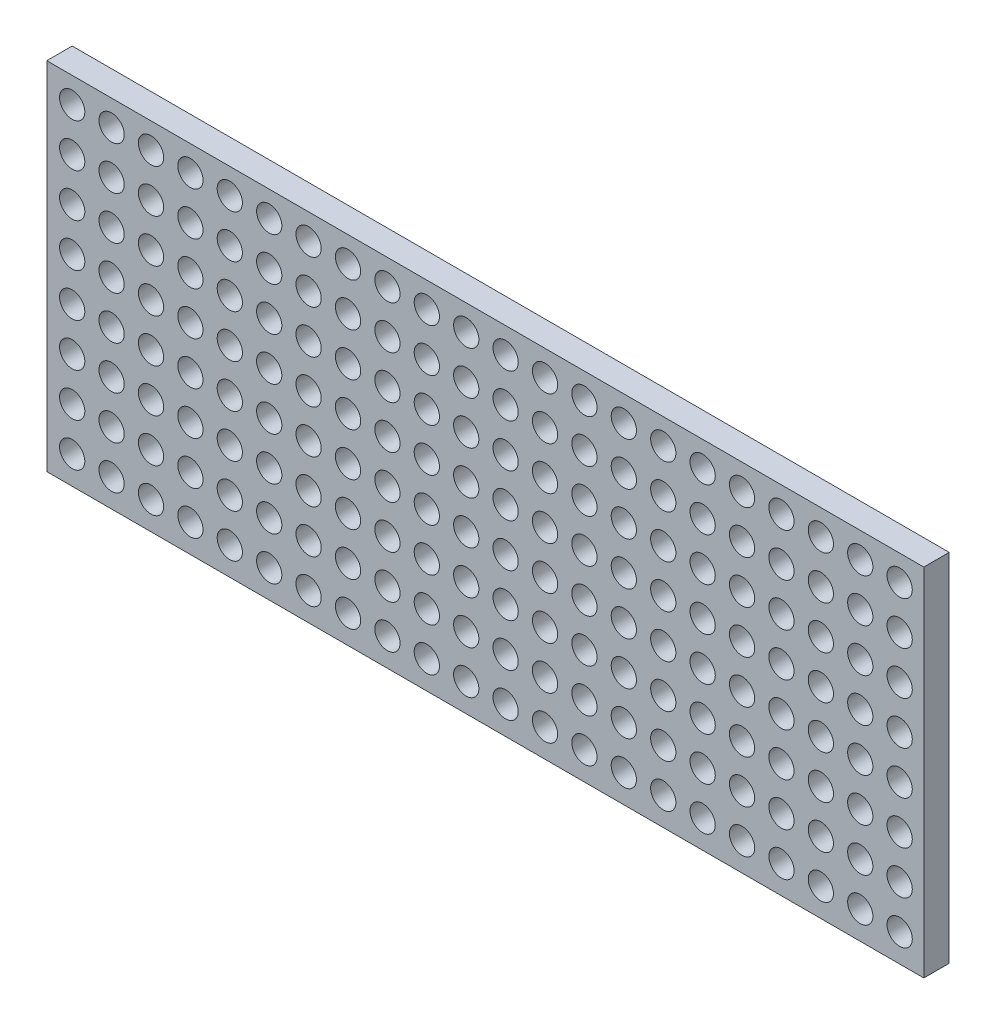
SolidWorks part; units mm, degrees
ref_plane "정면" through (0, 0, 0) normal (0, 0, 1) x (1, 0, 0)
ref_plane "윗면" through (0, 0, 0) normal (0, 1, 0) x (1, 0, 0)
ref_plane "우측면" through (0, 0, 0) normal (1, 0, 0) x (0, 0, -1)
sketch "스케치1" plane through (0, 0, 0) normal (0, 0, 1) x (1, 0, 0)
  line L1 (-3.45, 1.4) -> (3.45, 1.4)
  line L2 (-3.45, 1.4) -> (-3.45, -1.4)
  line L3 (-3.45, -1.4) -> (3.45, -1.4)
  line L4 (3.45, 1.4) -> (3.45, -1.4)
  line L5 (-3.45, 1.4) -> (3.45, -1.4) construction
  line L6 (-3.45, -1.4) -> (3.45, 1.4) construction
  point P0 (0, 0)
extrude "보스-돌출1" add sketch "스케치1" along normal blind 0.2
sketch "스케치2" plane through (0, 0, 0.2) normal (0, 0, 1) x (1, 0, 0)
  circle A0 centre (-3.25, 1.2) radius 0.0993
  circle A1 centre (-2.94, 1.2) radius 0.0993
  circle A2 centre (-2.63, 1.2) radius 0.0993
  circle A3 centre (-2.32, 1.2) radius 0.0993
  circle A4 centre (-2.01, 1.2) radius 0.0993
  circle A5 centre (-1.7, 1.2) radius 0.0993
  circle A6 centre (-1.39, 1.2) radius 0.0993
  circle A7 centre (-1.08, 1.2) radius 0.0993
  circle A8 centre (-0.77, 1.2) radius 0.0993
  circle A9 centre (-0.46, 1.2) radius 0.0993
  circle A10 centre (-0.15, 1.2) radius 0.0993
  circle A11 centre (0.16, 1.2) radius 0.0993
  circle A12 centre (0.47, 1.2) radius 0.0993
  circle A13 centre (0.78, 1.2) radius 0.0993
  circle A14 centre (1.09, 1.2) radius 0.0993
  circle A15 centre (1.4, 1.2) radius 0.0993
  circle A16 centre (1.71, 1.2) radius 0.0993
  circle A17 centre (2.02, 1.2) radius 0.0993
  circle A18 centre (2.33, 1.2) radius 0.0993
  circle A19 centre (2.64, 1.2) radius 0.0993
  circle A20 centre (2.95, 1.2) radius 0.0993
  circle A21 centre (3.26, 1.2) radius 0.0993
  circle A22 centre (-2.94, 0.86) radius 0.0993
  circle A23 centre (-2.63, 0.86) radius 0.0993
  circle A24 centre (-2.32, 0.86) radius 0.0993
  circle A25 centre (-2.01, 0.86) radius 0.0993
  circle A26 centre (-1.7, 0.86) radius 0.0993
  circle A27 centre (-1.39, 0.86) radius 0.0993
  circle A28 centre (-1.08, 0.86) radius 0.0993
  circle A29 centre (-0.77, 0.86) radius 0.0993
  circle A30 centre (-0.46, 0.86) radius 0.0993
  circle A31 centre (-0.15, 0.86) radius 0.0993
  circle A32 centre (0.16, 0.86) radius 0.0993
  circle A33 centre (0.47, 0.86) radius 0.0993
  circle A34 centre (0.78, 0.86) radius 0.0993
  circle A35 centre (1.09, 0.86) radius 0.0993
  circle A36 centre (1.4, 0.86) radius 0.0993
  circle A37 centre (1.71, 0.86) radius 0.0993
  circle A38 centre (2.02, 0.86) radius 0.0993
  circle A39 centre (2.33, 0.86) radius 0.0993
  circle A40 centre (2.64, 0.86) radius 0.0993
  circle A41 centre (2.95, 0.86) radius 0.0993
  circle A42 centre (3.26, 0.86) radius 0.0993
  circle A43 centre (-2.94, 0.52) radius 0.0993
  circle A44 centre (-2.63, 0.52) radius 0.0993
  circle A45 centre (-2.32, 0.52) radius 0.0993
  circle A46 centre (-2.01, 0.52) radius 0.0993
  circle A47 centre (-1.7, 0.52) radius 0.0993
  circle A48 centre (-1.39, 0.52) radius 0.0993
  circle A49 centre (-1.08, 0.52) radius 0.0993
  circle A50 centre (-0.77, 0.52) radius 0.0993
  circle A51 centre (-0.46, 0.52) radius 0.0993
  circle A52 centre (-0.15, 0.52) radius 0.0993
  circle A53 centre (0.16, 0.52) radius 0.0993
  circle A54 centre (0.47, 0.52) radius 0.0993
  circle A55 centre (0.78, 0.52) radius 0.0993
  circle A56 centre (1.09, 0.52) radius 0.0993
  circle A57 centre (1.4, 0.52) radius 0.0993
  circle A58 centre (1.71, 0.52) radius 0.0993
  circle A59 centre (2.02, 0.52) radius 0.0993
  circle A60 centre (2.33, 0.52) radius 0.0993
  circle A61 centre (2.64, 0.52) radius 0.0993
  circle A62 centre (2.95, 0.52) radius 0.0993
  circle A63 centre (3.26, 0.52) radius 0.0993
  circle A64 centre (-2.94, 0.18) radius 0.0993
  circle A65 centre (-2.63, 0.18) radius 0.0993
  circle A66 centre (-2.32, 0.18) radius 0.0993
  circle A67 centre (-2.01, 0.18) radius 0.0993
  circle A68 centre (-1.7, 0.18) radius 0.0993
  circle A69 centre (-1.39, 0.18) radius 0.0993
  circle A70 centre (-1.08, 0.18) radius 0.0993
  circle A71 centre (-0.77, 0.18) radius 0.0993
  circle A72 centre (-0.46, 0.18) radius 0.0993
  circle A73 centre (-0.15, 0.18) radius 0.0993
  circle A74 centre (0.16, 0.18) radius 0.0993
  circle A75 centre (0.47, 0.18) radius 0.0993
  circle A76 centre (0.78, 0.18) radius 0.0993
  circle A77 centre (1.09, 0.18) radius 0.0993
  circle A78 centre (1.4, 0.18) radius 0.0993
  circle A79 centre (1.71, 0.18) radius 0.0993
  circle A80 centre (2.02, 0.18) radius 0.0993
  circle A81 centre (2.33, 0.18) radius 0.0993
  circle A82 centre (2.64, 0.18) radius 0.0993
  circle A83 centre (2.95, 0.18) radius 0.0993
  circle A84 centre (3.26, 0.18) radius 0.0993
  circle A85 centre (-2.94, -0.16) radius 0.0993
  circle A86 centre (-2.63, -0.16) radius 0.0993
  circle A87 centre (-2.32, -0.16) radius 0.0993
  circle A88 centre (-2.01, -0.16) radius 0.0993
  circle A89 centre (-1.7, -0.16) radius 0.0993
  circle A90 centre (-1.39, -0.16) radius 0.0993
  circle A91 centre (-1.08, -0.16) radius 0.0993
  circle A92 centre (-0.77, -0.16) radius 0.0993
  circle A93 centre (-0.46, -0.16) radius 0.0993
  circle A94 centre (-0.15, -0.16) radius 0.0993
  circle A95 centre (0.16, -0.16) radius 0.0993
  circle A96 centre (0.47, -0.16) radius 0.0993
  circle A97 centre (0.78, -0.16) radius 0.0993
  circle A98 centre (1.09, -0.16) radius 0.0993
  circle A99 centre (1.4, -0.16) radius 0.0993
  circle A100 centre (1.71, -0.16) radius 0.0993
  circle A101 centre (2.02, -0.16) radius 0.0993
  circle A102 centre (2.33, -0.16) radius 0.0993
  circle A103 centre (2.64, -0.16) radius 0.0993
  circle A104 centre (2.95, -0.16) radius 0.0993
  circle A105 centre (3.26, -0.16) radius 0.0993
  circle A106 centre (-2.94, -0.5) radius 0.0993
  circle A107 centre (-2.63, -0.5) radius 0.0993
  circle A108 centre (-2.32, -0.5) radius 0.0993
  circle A109 centre (-2.01, -0.5) radius 0.0993
  circle A110 centre (-1.7, -0.5) radius 0.0993
  circle A111 centre (-1.39, -0.5) radius 0.0993
  circle A112 centre (-1.08, -0.5) radius 0.0993
  circle A113 centre (-0.77, -0.5) radius 0.0993
  circle A114 centre (-0.46, -0.5) radius 0.0993
  circle A115 centre (-0.15, -0.5) radius 0.0993
  circle A116 centre (0.16, -0.5) radius 0.0993
  circle A117 centre (0.47, -0.5) radius 0.0993
  circle A118 centre (0.78, -0.5) radius 0.0993
  circle A119 centre (1.09, -0.5) radius 0.0993
  circle A120 centre (1.4, -0.5) radius 0.0993
  circle A121 centre (1.71, -0.5) radius 0.0993
  circle A122 centre (2.02, -0.5) radius 0.0993
  circle A123 centre (2.33, -0.5) radius 0.0993
  circle A124 centre (2.64, -0.5) radius 0.0993
  circle A125 centre (2.95, -0.5) radius 0.0993
  circle A126 centre (3.26, -0.5) radius 0.0993
  circle A127 centre (-2.94, -0.84) radius 0.0993
  circle A128 centre (-2.63, -0.84) radius 0.0993
  circle A129 centre (-2.32, -0.84) radius 0.0993
  circle A130 centre (-2.01, -0.84) radius 0.0993
  circle A131 centre (-1.7, -0.84) radius 0.0993
  circle A132 centre (-1.39, -0.84) radius 0.0993
  circle A133 centre (-1.08, -0.84) radius 0.0993
  circle A134 centre (-0.77, -0.84) radius 0.0993
  circle A135 centre (-0.46, -0.84) radius 0.0993
  circle A136 centre (-0.15, -0.84) radius 0.0993
  circle A137 centre (0.16, -0.84) radius 0.0993
  circle A138 centre (0.47, -0.84) radius 0.0993
  circle A139 centre (0.78, -0.84) radius 0.0993
  circle A140 centre (1.09, -0.84) radius 0.0993
  circle A141 centre (1.4, -0.84) radius 0.0993
  circle A142 centre (1.71, -0.84) radius 0.0993
  circle A143 centre (2.02, -0.84) radius 0.0993
  circle A144 centre (2.33, -0.84) radius 0.0993
  circle A145 centre (2.64, -0.84) radius 0.0993
  circle A146 centre (2.95, -0.84) radius 0.0993
  circle A147 centre (3.26, -0.84) radius 0.0993
  circle A148 centre (-2.94, -1.18) radius 0.0993
  circle A149 centre (-2.63, -1.18) radius 0.0993
  circle A150 centre (-2.32, -1.18) radius 0.0993
  circle A151 centre (-2.01, -1.18) radius 0.0993
  circle A152 centre (-1.7, -1.18) radius 0.0993
  circle A153 centre (-1.39, -1.18) radius 0.0993
  circle A154 centre (-1.08, -1.18) radius 0.0993
  circle A155 centre (-0.77, -1.18) radius 0.0993
  circle A156 centre (-0.46, -1.18) radius 0.0993
  circle A157 centre (-0.15, -1.18) radius 0.0993
  circle A158 centre (0.16, -1.18) radius 0.0993
  circle A159 centre (0.47, -1.18) radius 0.0993
  circle A160 centre (0.78, -1.18) radius 0.0993
  circle A161 centre (1.09, -1.18) radius 0.0993
  circle A162 centre (1.4, -1.18) radius 0.0993
  circle A163 centre (1.71, -1.18) radius 0.0993
  circle A164 centre (2.02, -1.18) radius 0.0993
  circle A165 centre (2.33, -1.18) radius 0.0993
  circle A166 centre (2.64, -1.18) radius 0.0993
  circle A167 centre (2.95, -1.18) radius 0.0993
  circle A168 centre (3.26, -1.18) radius 0.0993
  circle A169 centre (-3.25, 0.86) radius 0.0993
  circle A170 centre (-3.25, 0.52) radius 0.0993
  circle A171 centre (-3.25, 0.18) radius 0.0993
  circle A172 centre (-3.25, -0.16) radius 0.0993
  circle A173 centre (-3.25, -0.5) radius 0.0993
  circle A174 centre (-3.25, -0.84) radius 0.0993
  circle A175 centre (-3.25, -1.18) radius 0.0993
  dimension "D1" = 22
  dimension "D2" = 8
extrude "컷-돌출1" cut sketch "스케치2" against normal blind 0.2
